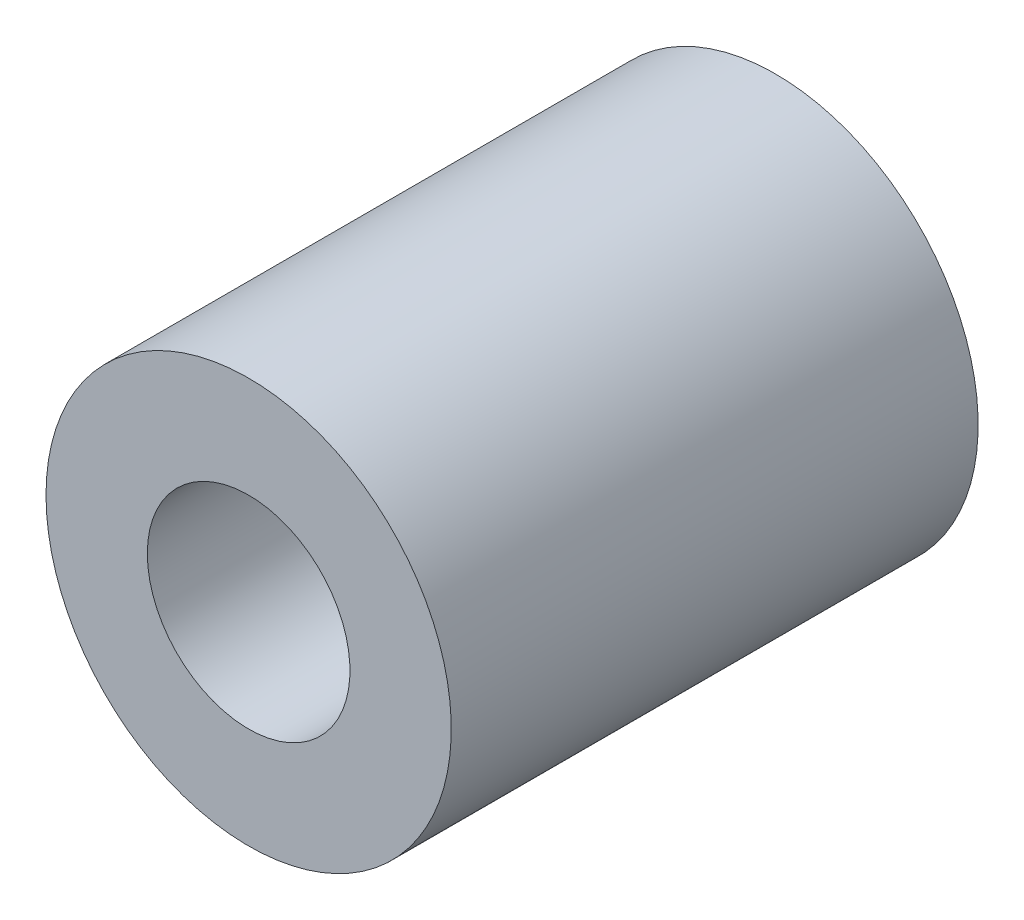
SolidWorks part; units mm, degrees
ref_plane "Face" through (0, 0, 0) normal (0, 0, 1) x (1, 0, 0)
ref_plane "Dessus" through (0, 0, 0) normal (0, 1, 0) x (1, 0, 0)
ref_plane "Droite" through (0, 0, 0) normal (1, 0, 0) x (0, 0, -1)
sketch "Esquisse1" plane through (0, 0, 0) normal (0, 0, 1) x (1, 0, 0)
  circle A0 centre (0, 0) radius 5
  circle A1 centre (0, 0) radius 10
  dimension "D1" = 10
  dimension "D2" = 20
extrude "Base-Extrusion" add sketch "Esquisse1" along normal blind 26
